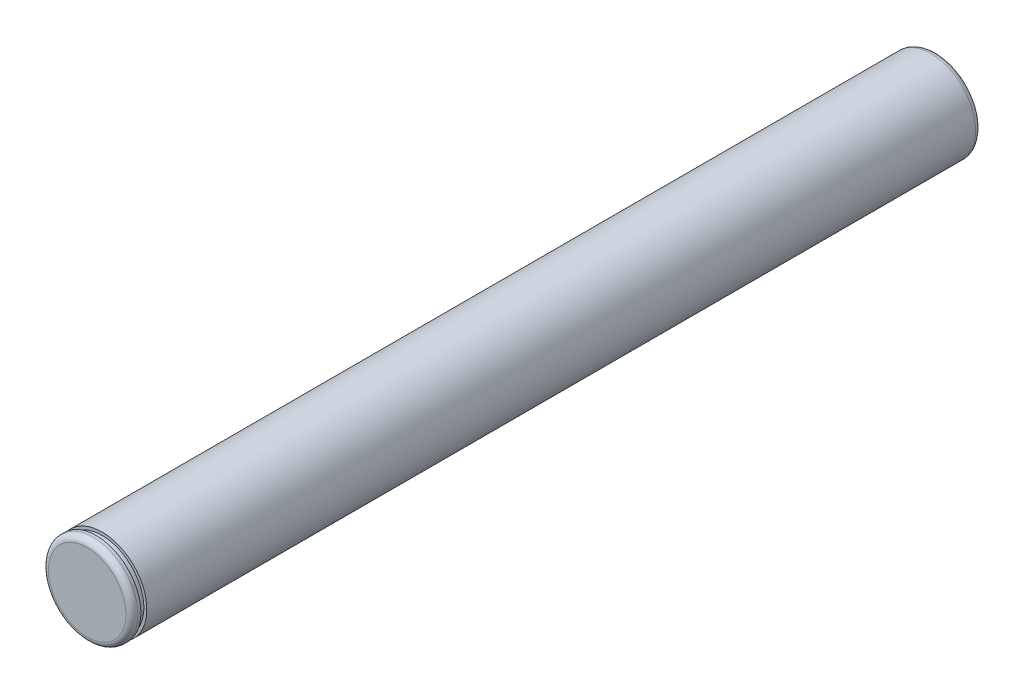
SolidWorks part; units mm, degrees
ref_plane "XY" through (0, 0, 0) normal (0, 0, 1) x (1, 0, 0)
ref_plane "XZ" through (0, 0, 0) normal (0, 1, 0) x (1, 0, 0)
ref_plane "YZ" through (0, 0, 0) normal (1, 0, 0) x (0, 0, -1)
sketch "Esquisse1" plane through (0, 0, 0) normal (0, 0, 1) x (1, 0, 0)
  circle A0 centre (0, 0) radius 1.5 construction
  circle A1 centre (0, 0) radius 1.5
extrude "Boss.-Extru.1" add sketch "Esquisse1" along normal offset from surface (28.5 mm away) 2
fillet "Congé1" radius 0.2 2 edges at (1.5, 0, 28.5) (1.5, 0, 0)
sketch "Esquisse2" plane through (0, 0, 0) normal (0, 1, 0) x (1, 0, 0)
  line L0 (-3, -26.5) -> (3, -26.5) construction
  line L1 (1.5, -28) -> (1.4, -28)
  line L2 (1.5, -28) -> (1.5, -28.2)
  line L3 (1.5, -28.2) -> (1.4, -28.2)
  line L4 (1.4, -28) -> (1.4, -28.2)
  line L5 (1.5, -28.3) -> (1.5, -0.2) construction
  line L6 (0, -24.636) -> (0, -29.3964) construction
  dimension "D1" = 1.5
  dimension "D2" = 0.2
  dimension "D3" = 0.1
revolve "Enlèvement de matière-Révolution1" cut sketch "Esquisse2" angle 360 about L6
